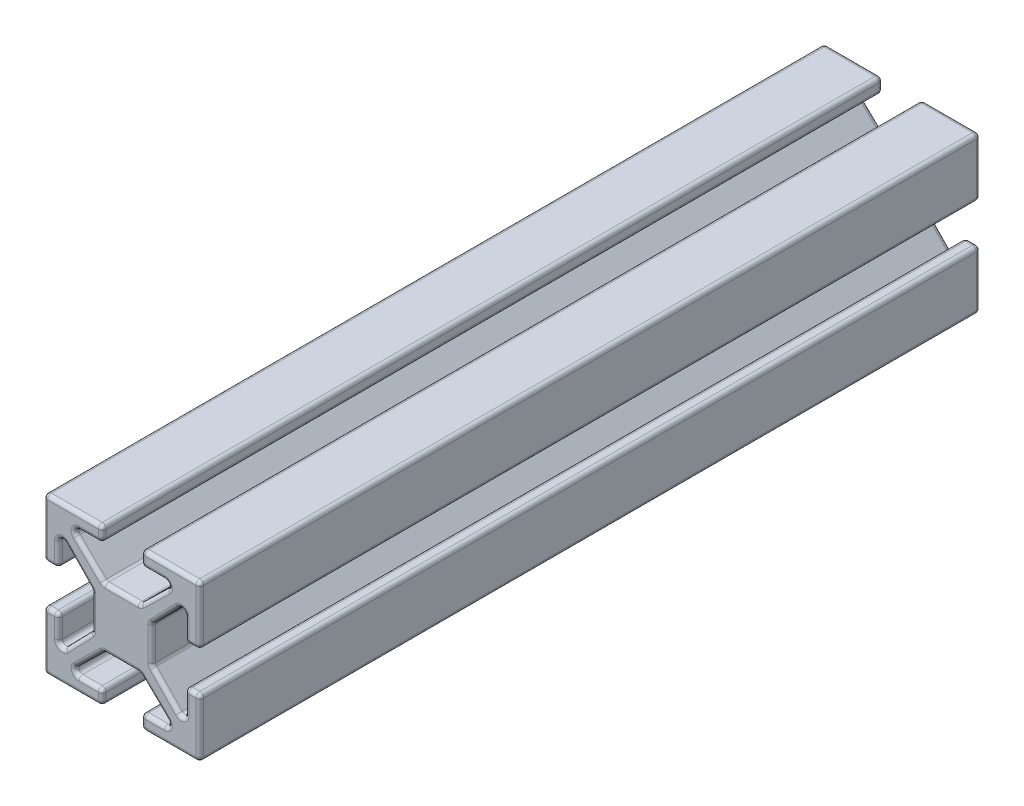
SolidWorks part; units mm, degrees
ref_plane "Front Plane" through (0, 0, 0) normal (0, 0, 1) x (1, 0, 0)
ref_plane "Top Plane" through (0, 0, 0) normal (0, 1, 0) x (1, 0, 0)
ref_plane "Right Plane" through (0, 0, 0) normal (1, 0, 0) x (0, 0, -1)
sketch "Sketch1" plane through (0, 0, 0) normal (0, 0, 1) x (1, 0, 0)
  line L0 (-5, 20) -> (-5, 16.2126)
  line L1 (-20, -20) -> (20, -20)
  line L2 (-20, -20) -> (-20, 20)
  line L3 (-20, 20) -> (20, 20)
  line L4 (20, -20) -> (20, 20)
  line L5 (-20, -20) -> (20, 20) construction
  line L6 (-20, 20) -> (20, -20) construction
  line L7 (-5, 16.2126) -> (-13.4323, 16.2126)
  line L8 (-13.4323, 16.2126) -> (-4.6312, 7.6894)
  line L9 (-4.6312, 7.6894) -> (0, 7.6894)
  line L10 (-7.6894, 4.6312) -> (-7.6894, 0)
  line L11 (-16.2126, 13.4323) -> (-7.6894, 4.6312)
  line L12 (-16.2126, 5) -> (-16.2126, 13.4323)
  line L13 (-20, 5) -> (-16.2126, 5)
  line L14 (0, 7.6894) -> (0, 16.8611) construction
  line L15 (0, 0) -> (-11.384, 0) construction
  line L16 (5, 20) -> (5, 16.2126)
  line L17 (5, 16.2126) -> (13.4323, 16.2126)
  line L18 (13.4323, 16.2126) -> (4.6312, 7.6894)
  line L19 (16.2126, 13.4323) -> (7.6894, 4.6312)
  line L20 (16.2126, 5) -> (16.2126, 13.4323)
  line L21 (20, 5) -> (16.2126, 5)
  line L22 (7.6894, 4.6312) -> (7.6894, 0)
  line L23 (4.6312, 7.6894) -> (0, 7.6894)
  line L24 (20, -5) -> (16.2126, -5)
  line L25 (16.2126, -5) -> (16.2126, -13.4323)
  line L26 (16.2126, -13.4323) -> (7.6894, -4.6312)
  line L27 (13.4323, -16.2126) -> (4.6312, -7.6894)
  line L28 (5, -16.2126) -> (13.4323, -16.2126)
  line L29 (5, -20) -> (5, -16.2126)
  line L30 (4.6312, -7.6894) -> (0, -7.6894)
  line L31 (7.6894, -4.6312) -> (7.6894, 0)
  line L32 (-5, -20) -> (-5, -16.2126)
  line L33 (-5, -16.2126) -> (-13.4323, -16.2126)
  line L34 (-13.4323, -16.2126) -> (-4.6312, -7.6894)
  line L35 (-16.2126, -13.4323) -> (-7.6894, -4.6312)
  line L36 (-16.2126, -5) -> (-16.2126, -13.4323)
  line L37 (-20, -5) -> (-16.2126, -5)
  line L38 (-7.6894, -4.6312) -> (-7.6894, 0)
  line L39 (-4.6312, -7.6894) -> (0, -7.6894)
  point P0 (0, 0)
  point P52 (0, 0)
  dimension "D1" = 40
  dimension "D2" = 40
  dimension "D4" = 15
  dimension "D3" = 4
extrude "Boss-Extrude1" add sketch "Sketch1" along normal blind 200 contours L34 L39 L30 L27 L28 L29 L1 L4 L24 L25 L26 L31 L22 L19 L20 L21 L3 L16 L17 L18 L23 L9 L8 L7 L0 L2 L13 L12 L11 L10 L38 L35 L36 L37 L32 L33
fillet "Fillet3" radius 1 108 edges at (-9.0317, -11.951, 0) (0, -7.6894, 0) (9.0317, -11.951, 0) (9.2161, -16.2126, 0) (5, -18.1063, 0) (12.5, -20, 0) (20, -12.5, 0) (18.1063, -5, 0) (16.2126, -9.2161, 0) (11.951, -9.0317, 0) (7.6894, 0, 0) (11.951, 9.0317, 0) (16.2126, 9.2161, 0) (18.1063, 5, 0) (20, 12.5, 0) (5, 18.1063, 0) (9.2161, 16.2126, 0) (9.0317, 11.951, 0) (0, 7.6894, 0) (-9.0317, 11.951, 0) (-9.2161, 16.2126, 0) (-5, 18.1063, 0) (-12.5, 20, 0) (-20, 12.5, 0) (-18.1063, 5, 0) (-16.2126, 9.2161, 0) (-11.951, 9.0317, 0) (-7.6894, 0, 0) (-11.951, -9.0317, 0) (-16.2126, -9.2161, 0) (-18.1063, -5, 0) (-20, -12.5, 0) (-12.5, -20, 0) (-5, -18.1063, 0) (-9.2161, -16.2126, 0) (-9.0317, -11.951, 200) (0, -7.6894, 200) (9.0317, -11.951, 200) (9.2161, -16.2126, 200) (5, -18.1063, 200) (12.5, -20, 200) (20, -12.5, 200) (18.1063, -5, 200) (16.2126, -9.2161, 200) (11.951, -9.0317, 200) (7.6894, 0, 200) (11.951, 9.0317, 200) (16.2126, 9.2161, 200) (18.1063, 5, 200) (20, 12.5, 200) (12.5, 20, 200) (5, 18.1063, 200) (9.2161, 16.2126, 200) (9.0317, 11.951, 200) (0, 7.6894, 200) (-9.0317, 11.951, 200) (-9.2161, 16.2126, 200) (-5, 18.1063, 200) (-12.5, 20, 200) (-20, 12.5, 200) (-18.1063, 5, 200) (-16.2126, 9.2161, 200) (-11.951, 9.0317, 200) (-7.6894, 0, 200) (-11.951, -9.0317, 200) (-16.2126, -9.2161, 200) (-18.1063, -5, 200) (-20, -12.5, 200) (-12.5, -20, 200) (-5, -18.1063, 200) (-9.2161, -16.2126, 200) (-13.4323, -16.2126, 100) (-5, -16.2126, 100) (-5, -20, 100) (-20, -20, 100) (-20, -5, 100) (-16.2126, -5, 100) (-16.2126, -13.4323, 100) (-7.6894, -4.6312, 100) (-7.6894, 4.6312, 100) (-16.2126, 13.4323, 100) (-16.2126, 5, 100) (-20, 5, 100) (-20, 20, 100) (-5, 20, 100) (-5, 16.2126, 100) (-13.4323, 16.2126, 100) (-4.6312, 7.6894, 100) (4.6312, 7.6894, 100) (13.4323, 16.2126, 100) (5, 16.2126, 100) (5, 20, 100) (20, 20, 100) (20, 5, 100) (16.2126, 5, 100) (16.2126, 13.4323, 100) (7.6894, 4.6312, 100) (7.6894, -4.6312, 100) (16.2126, -13.4323, 100) (16.2126, -5, 100) (20, -5, 100) (20, -20, 100) (5, -20, 100) (5, -16.2126, 100) (13.4323, -16.2126, 100) (4.6312, -7.6894, 100) (-4.6312, -7.6894, 100) (12.5, 20, 0)
